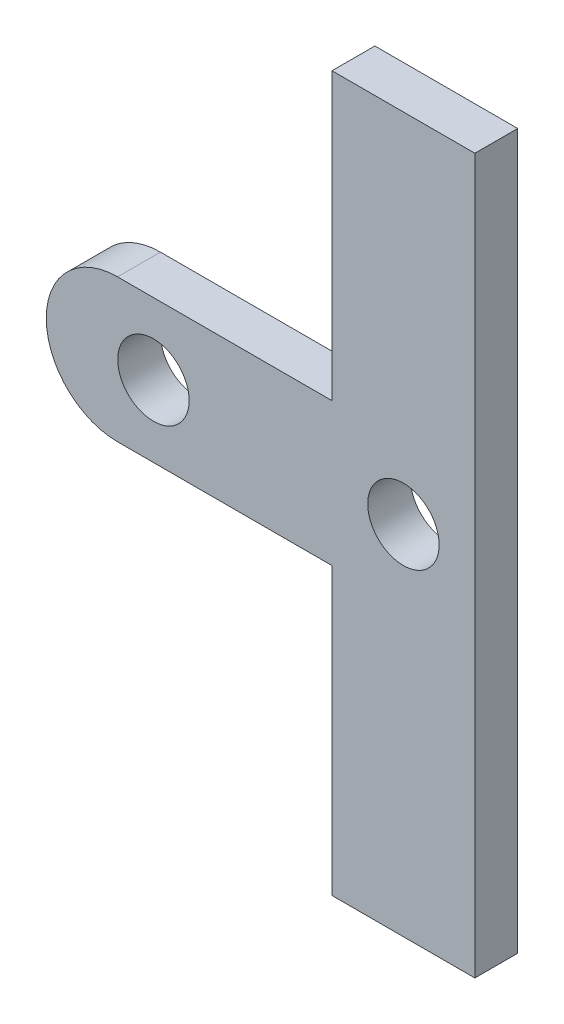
SolidWorks part; units mm, degrees
ref_plane "Plan de face" through (0, 0, 0) normal (0, 0, 1) x (1, 0, 0)
ref_plane "Plan de dessus" through (0, 0, 0) normal (0, 1, 0) x (1, 0, 0)
ref_plane "Plan de droite" through (0, 0, 0) normal (1, 0, 0) x (0, 0, -1)
sketch "Esquisse1" plane through (0, 0, 0) normal (0, 0, 1) x (1, 0, 0)
  line L0 (-45.3497, 10) -> (-30.3397, 10)
  line L1 (-30.3397, 10) -> (-30.3397, 30)
  line L2 (-30.3397, 30) -> (-20.3397, 30)
  line L3 (-20.3397, 30) -> (-20.3397, -20)
  line L4 (-20.3397, -20) -> (-30.3397, -20)
  line L5 (-30.3397, -20) -> (-30.3397, 0)
  line L6 (-30.3397, 0) -> (-45.3497, 0)
  line L7 (-50.3397, 4.99) -> (-50.3397, 5.01)
  circle A0 centre (-42.8397, 5) radius 2.5
  circle A1 centre (-25.3397, 5) radius 2.5
  arc A2 (-50.3397, 5.01) -> (-45.3497, 10) centre (-45.3497, 5.01) cw
  arc A3 (-45.3497, 0) -> (-50.3397, 4.99) centre (-45.3497, 4.99) cw
  point P14 (-50.3397, 10)
  point P17 (-50.3397, 0)
  dimension "D6" = 5
  dimension "D7" = 5
  dimension "D8" = 5
  dimension "D10" = 5
  dimension "D11" = 5
  dimension "D12" = 4.99
  dimension "D1" = 20
  dimension "D2" = 10
  dimension "D3" = 10
  dimension "D4" = 20
  dimension "D5" = 20
  dimension "D9" = 5
extrude "Extrusion1" add sketch "Esquisse1" along normal blind 3
